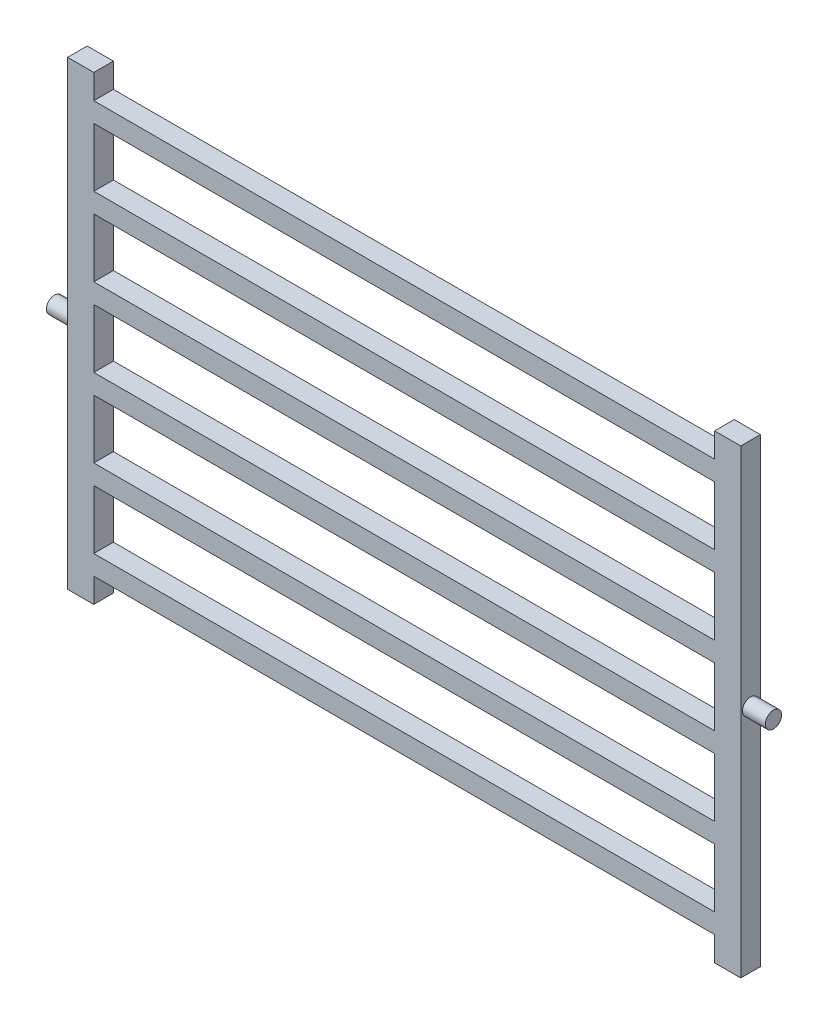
SolidWorks part; units mm, degrees
ref_plane "Front Plane" through (0, 0, 0) normal (0, 0, 1) x (1, 0, 0)
ref_plane "Top Plane" through (0, 0, 0) normal (0, 1, 0) x (1, 0, 0)
ref_plane "Right Plane" through (0, 0, 0) normal (1, 0, 0) x (0, 0, -1)
sketch "Sketch2" plane through (0, 0, 0) normal (0, 0, 1) x (1, 0, 0)
  line L1 (7, 158) -> (15, 158)
  line L2 (7, 158) -> (7, 17)
  line L3 (7, 17) -> (15, 17)
  line L4 (15, 158) -> (15, 17)
  line L5 (213, 158) -> (205, 158)
  line L6 (213, 158) -> (213, 17)
  line L7 (213, 17) -> (205, 17)
  line L8 (205, 158) -> (205, 17)
extrude "Boss-Extrude3" add sketch "Sketch2" along normal blind 6 from offset 2
sketch "Sketch3" plane through (0, 0, 0) normal (0, 0, 1) x (1, 0, 0)
  line L0 (15, 48.5) -> (205, 48.5)
  line L1 (15, 24.5) -> (205, 24.5)
  line L2 (15, 24.5) -> (15, 30.5)
  line L3 (15, 30.5) -> (205, 30.5)
  line L4 (205, 24.5) -> (205, 30.5)
  line L5 (15, 48.5) -> (15, 54.5)
  line L6 (15, 54.5) -> (205, 54.5)
  line L7 (205, 48.5) -> (205, 54.5)
  line L8 (15, 72.5) -> (205, 72.5)
  line L9 (15, 72.5) -> (15, 78.5)
  line L10 (15, 78.5) -> (205, 78.5)
  line L11 (205, 72.5) -> (205, 78.5)
  line L12 (15, 96.5) -> (205, 96.5)
  line L13 (15, 96.5) -> (15, 102.5)
  line L14 (15, 102.5) -> (205, 102.5)
  line L15 (205, 96.5) -> (205, 102.5)
  line L16 (15, 120.5) -> (205, 120.5)
  line L17 (15, 120.5) -> (15, 126.5)
  line L18 (15, 126.5) -> (205, 126.5)
  line L19 (205, 120.5) -> (205, 126.5)
  line L20 (15, 144.5) -> (205, 144.5)
  line L21 (15, 144.5) -> (15, 150.5)
  line L22 (15, 150.5) -> (205, 150.5)
  line L23 (205, 144.5) -> (205, 150.5)
  dimension "D1" = 6
extrude "Boss-Extrude4" add sketch "Sketch3" along normal blind 6 from offset 2
sketch "Sketch8" plane through (7, 0, 0) normal (-1, 0, 0) x (0, 0, 1)
  line L0 (8, 158) -> (8, 17) construction
  line L2 (8, 158) -> (2, 158) construction
  circle A0 centre (5, 87.5) radius 2.5
  dimension "D1" = 5
  dimension "D2" = 3
  dimension "D3" = 70.5
extrude "Boss-Extrude7" add sketch "Sketch8" along normal blind 7
sketch "Sketch9" plane through (213, 0, 0) normal (1, 0, 0) x (0, 0, -1)
  line L0 (-2, 17) -> (-2, 158) construction
  line L1 (-8, 158) -> (-2, 158) construction
  line L2 (-8, 17) -> (-2, 17) construction
  circle A0 centre (-5, 87.5) radius 2.5
  point P8 (-5, 17)
  dimension "D1" = 5
  dimension "D2" = 3
  dimension "D3" = 70.5
  dimension "D4" = 70.5
extrude "Boss-Extrude8" add sketch "Sketch9" along normal blind 7
